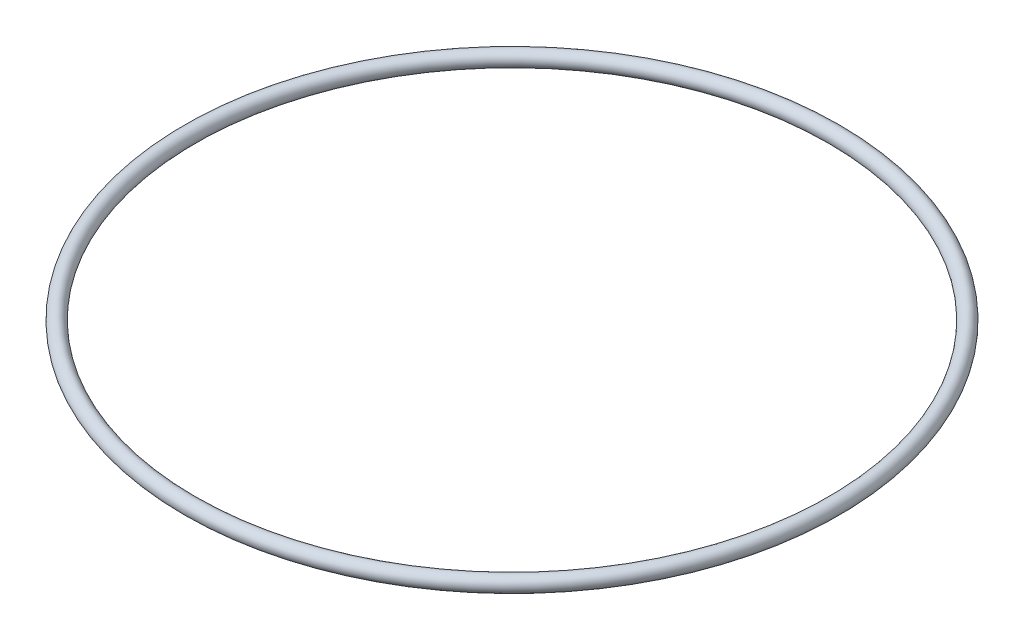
SolidWorks part; units mm, degrees
ref_plane "Plan1" through (0, 0, 0) normal (0, 0, 1) x (1, 0, 0)
ref_plane "Plan2" through (0, 0, 0) normal (0, 1, 0) x (1, 0, 0)
ref_plane "Plan3" through (0, 0, 0) normal (1, 0, 0) x (0, 0, -1)
sketch "Esquisse1" plane through (0, 0, 0) normal (0, 0, 1) x (1, 0, 0)
  line L1 (0, 0) -> (125, 0) construction
  line L2 (0, 1.5) -> (0, -1.5) construction
  circle A0 centre (64, 0) radius 1.5
  dimension "D2" = 64
  dimension "D1" = 3
  dimension "Diamètre du tore" = 3
  dimension "Diamètre intérieur" = 125
revolve "Base-Révolution" add sketch "Esquisse1" angle 360 about L2
equation " \"D1@Esquisse1\"=\"Diamètre du tore@Esquisse1\" "
equation "\"D2@Esquisse1\" = (\"Diamètre intérieur@Esquisse1\"/2)+(\"Diamètre du tore@Esquisse1\"/2)"
